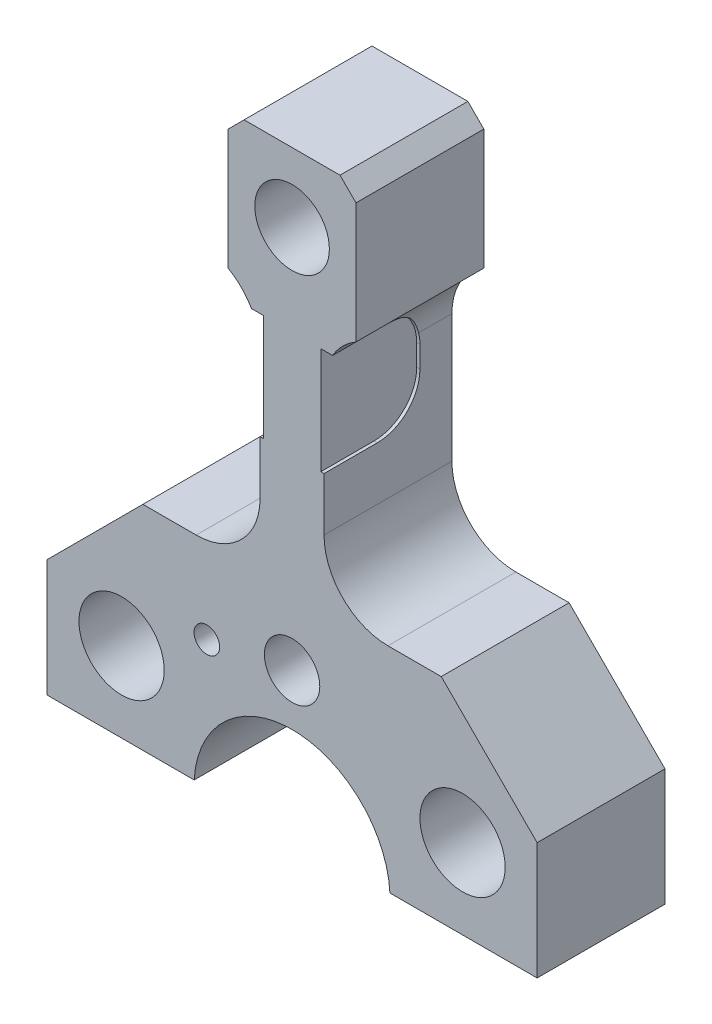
SolidWorks part; units mm, degrees
ref_plane "Plan1" through (0, 0, 0) normal (0, 0, 1) x (1, 0, 0)
ref_plane "Plan2" through (0, 0, 0) normal (0, 1, 0) x (1, 0, 0)
ref_plane "Plan3" through (0, 0, 0) normal (1, 0, 0) x (0, 0, -1)
sketch "Esquisse1" plane through (0, 0, 0) normal (0, 0, 1) x (1, 0, 0)
  line L0 (0, 0) -> (46, 0)
  line L1 (0, 0) -> (0, 56)
  line L2 (46, 56) -> (0, 56)
  line L3 (46, 56) -> (46, 0)
  dimension "D1" = 56
  dimension "D2" = 46
extrude "Base-Extrusion" add sketch "Esquisse1" along normal blind 12
sketch "Esquisse4" plane through (0, 0, 12) normal (0, 0, 1) x (1, 0, 0)
  line L0 (0, 0) -> (46, 0) construction
  line L3 (0, 0) -> (0, 56) construction
  line L4 (13.8136, 0) -> (32.1864, 0)
  arc A0 (32.1864, 0) -> (13.8136, 0) centre (23, -0.5) ccw
  dimension "D1" = 8.7
  dimension "D2" = 23
  dimension "D3" = 9.2
extrude "Enlèv. mat.-Extru.3" cut sketch "Esquisse4" against normal blind 12
sketch "Esquisse6" plane through (0, 0, 12) normal (0, 0, 1) x (1, 0, 0)
  line L0 (0, 0) -> (13.8136, 0) construction
  line L1 (32.1864, 0) -> (46, 0) construction
  line L2 (26, 26) -> (26, 38)
  line L3 (29, 43.1962) -> (29, 56)
  line L5 (46, 56) -> (0, 56) construction
  line L6 (32, 20) -> (37, 20)
  line L7 (37, 20) -> (46, 11)
  line L8 (46, 56) -> (46, 0) construction
  line L9 (46, 56) -> (46, 11)
  line L10 (46, 56) -> (29, 56)
  line L11 (17, 43.1962) -> (17, 56)
  line L12 (20, 38) -> (20, 26)
  line L13 (14, 20) -> (9, 20)
  line L14 (9, 20) -> (0, 11)
  line L15 (0, 0) -> (0, 56) construction
  line L16 (17, 56) -> (0, 56)
  line L17 (0, 56) -> (0, 11)
  arc A0 (29, 43.1962) -> (26, 38) centre (32, 38) ccw
  arc A1 (26, 26) -> (32, 20) centre (32, 26) ccw
  arc A2 (20, 38) -> (17, 43.1962) centre (14, 38) ccw
  arc A3 (14, 20) -> (20, 26) centre (14, 26) ccw
  arc A4 (32.1864, 0) -> (13.8136, 0) centre (23, -0.5) ccw construction
  dimension "D1" = 12
  dimension "D2" = 12
  dimension "D3" = 6
  dimension "D4" = 12
  dimension "D5" = 45
  dimension "D6" = 11
  dimension "D7" = 11
  dimension "D8" = 20
  dimension "D9" = 3
extrude "Enlèv. mat.-Extru.4" cut sketch "Esquisse6" against normal through all
chamfer "Chanfrein6" distance 1.5 angle 45
chamfer "Chanfrein7" distance 1.5 angle 45
other "Perçage1"
sketch "Esquisse7" plane through (0, 0, 12) normal (0, 0, 1) x (1, 0, 0)
  line L0 (0, 0) -> (0, 11) construction
  line L1 (0, 0) -> (13.8136, 0) construction
  circle A0 centre (7, 7.5) radius 4
  dimension "D1" = 8
  dimension "D2" = 7
  dimension "D3" = 7.5
other "Perçage2" parameters "D1"=12
sketch "Esquisse8" plane through (0, 0, 12) normal (0, 0, 1) x (1, 0, 0)
  line L0 (46, 11) -> (46, 0) construction
  line L1 (32.1864, 0) -> (46, 0) construction
  circle A0 centre (39, 7.5) radius 4
  dimension "D1" = 8
  dimension "D2" = 7
  dimension "D3" = 7.5
other "Perçage3" parameters "D1"=12
sketch "Esquisse9" plane through (0, 0, 12) normal (0, 0, 1) x (1, 0, 0)
  line L0 (0, 0) -> (13.8136, 0) construction
  line L1 (0, 0) -> (0, 11) construction
  circle A0 centre (23, 13.5) radius 2.6
  dimension "D1" = 5.2
  dimension "D2" = 13.5
  dimension "D3" = 23
other "Perçage4" parameters "D1"=12
sketch "Esquisse10" plane through (0, 0, 12) normal (0, 0, 1) x (1, 0, 0)
  circle A0 centre (23, 49.5) radius 3.5
  dimension "D1" = 7
  dimension "D2" = 42
other "Perçage5" parameters "D1"=12
sketch "Esquisse11" plane through (0, 0, 12) normal (0, 0, 1) x (1, 0, 0)
  line L0 (0, 0) -> (13.8136, 0) construction
  circle A0 centre (15, 12) radius 1.2
  dimension "D1" = 2.4
  dimension "D2" = 8
  dimension "D3" = 12
sketch "Esquisse12" plane through (20, 0, 0) normal (-1, 0, 0) x (0, 0, 1)
  line L0 (12, 38) -> (12, 26) construction
  line L1 (12, 41) -> (7, 41)
  line L2 (12, 41) -> (12, 31)
  line L3 (12, 31) -> (7, 31)
  line L4 (3, 37) -> (3, 35)
  line L6 (12, 0) -> (0, 0) construction
  arc A0 (3, 37) -> (7, 41) centre (7, 37) cw
  arc A1 (3, 35) -> (7, 31) centre (7, 35) ccw
  point P10 (3, 41)
  dimension "D4" = 4
  dimension "D1" = 31
  dimension "D2" = 10
  dimension "D3" = 9
extrude "Enlèv. mat.-Extru.5" cut sketch "Esquisse12" against normal blind 0.3
sketch "Esquisse13" plane through (20.3, 0, 0) normal (-1, 0, 0) x (0, 0, 1)
  line L0 (3.127, 38) -> (12, 38) construction
  line L1 (3.127, 38) -> (12, 38)
  line L4 (12, 31) -> (12, 41)
  line L5 (12, 41) -> (7, 41)
  line L6 (3, 37) -> (3, 35)
  line L7 (7, 31) -> (12, 31)
  line L8 (12, 38) -> (12, 41)
  line L9 (12, 41) -> (7, 41)
  arc A2 (7, 41) -> (3, 37) centre (7, 37) ccw
  arc A3 (3, 35) -> (7, 31) centre (7, 35) ccw
  arc A4 (7, 41) -> (3.127, 38) centre (7, 37) ccw
  dimension "D1" = 0
extrude "Enlèv. mat.-Extru.6" cut sketch "Esquisse13" along normal through all
ref_plane "Plan4" through (25.7, 0, 0) normal (1, 0, 0) x (0, 0, -1)
sketch "Esquisse14" plane through (25.7, 0, 0) normal (1, 0, 0) x (0, 0, -1)
  line L4 (-3, 35) -> (-3, 37)
  line L5 (-12, 31) -> (-7, 31)
  line L6 (-12, 41) -> (-12, 31)
  line L7 (-7, 41) -> (-12, 41)
  line L8 (-3, 35) -> (-3, 37)
  line L9 (-12, 31) -> (-7, 31)
  line L10 (-12, 41) -> (-12, 31)
  line L11 (-7, 41) -> (-12, 41)
  arc A2 (-3, 37) -> (-7, 41) centre (-7, 37) ccw
  arc A3 (-7, 31) -> (-3, 35) centre (-7, 35) ccw
  arc A4 (-3, 37) -> (-7, 41) centre (-7, 37) ccw
  arc A5 (-7, 31) -> (-3, 35) centre (-7, 35) ccw
  dimension "D1" = 0
extrude "Enlèv. mat.-Extru.7" cut sketch "Esquisse14" along normal through all
